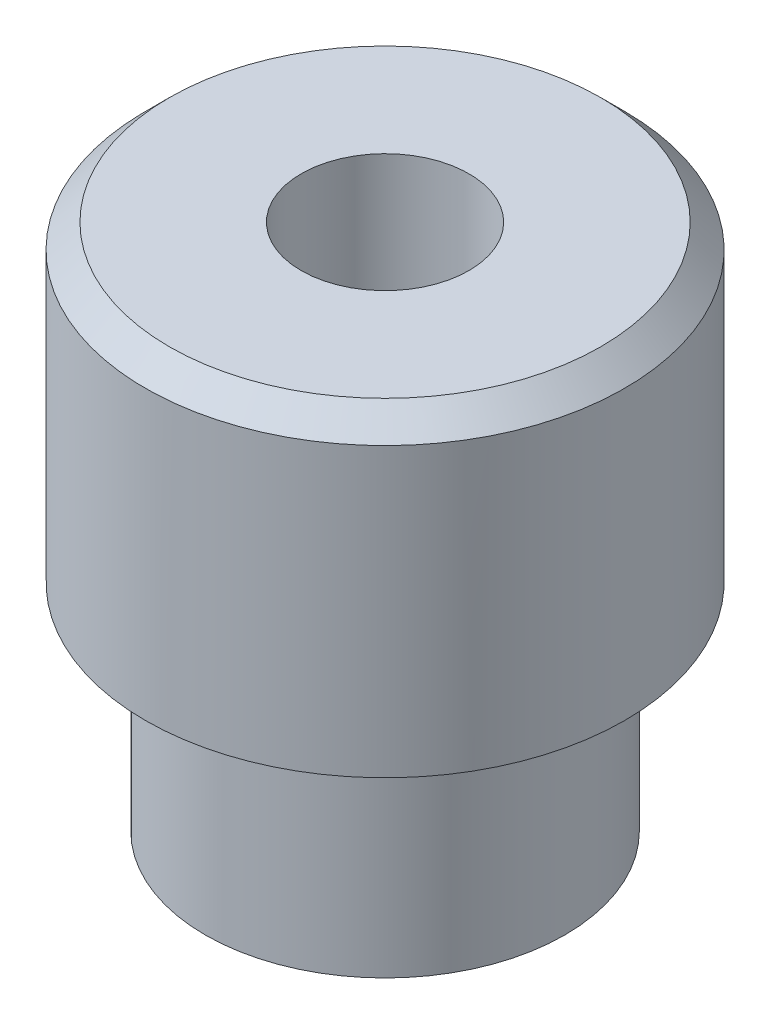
SolidWorks part; units mm, degrees
ref_plane "Přední rovina" through (0, 0, 0) normal (0, 0, 1) x (1, 0, 0)
ref_plane "Horní rovina" through (0, 0, 0) normal (0, 1, 0) x (1, 0, 0)
ref_plane "Pravá rovina" through (0, 0, 0) normal (1, 0, 0) x (0, 0, -1)
sketch "Skica1" plane through (0, 0, 0) normal (0, 1, 0) x (1, 0, 0)
  circle A0 centre (0, 0) radius 7.5
  dimension "D1" = 15
extrude "Přidat vysunutím1" add sketch "Skica1" along normal blind 9
sketch "Skica2" plane through (0, 9, 0) normal (0, 1, 0) x (1, 0, 0)
  circle A0 centre (0, 0) radius 10
  dimension "D1" = 20
extrude "Přidat vysunutím2" add sketch "Skica2" along normal blind 13
chamfer "Zkosení1" distance 1.5 distance2 2.5 1 edges at (0, 9, 7.5)
chamfer "Zkosení2" distance 1 angle 45 1 edges at (0, 22, 10)
sketch "Skica3" plane through (0, 22, 0) normal (0, 1, 0) x (1, 0, 0)
  circle A0 centre (0, 0) radius 3.5
  dimension "D1" = 7
extrude "Odebrat vysunutím1" cut sketch "Skica3" against normal through all
